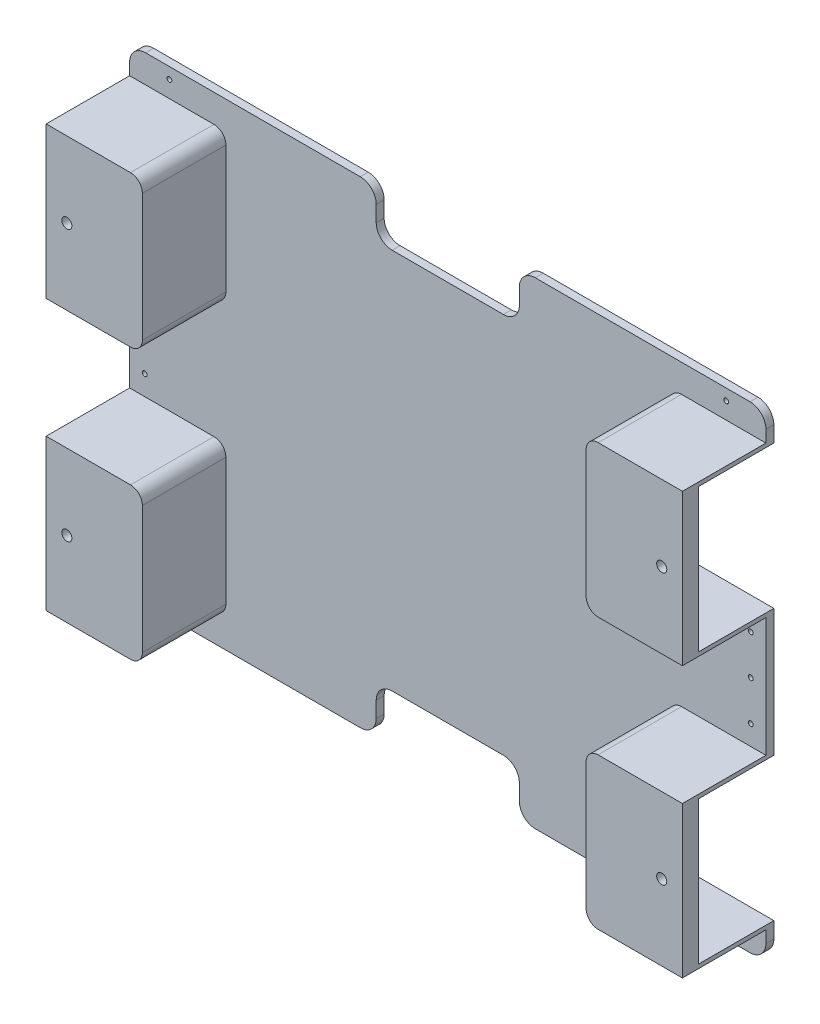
SolidWorks part; units mm, degrees
ref_plane "Plan de face" through (0, 0, 0) normal (0, 0, 1) x (1, 0, 0)
ref_plane "Plan de dessus" through (0, 0, 0) normal (0, 1, 0) x (1, 0, 0)
ref_plane "Plan de droite" through (0, 0, 0) normal (1, 0, 0) x (0, 0, -1)
sketch "Esquisse2" plane through (0, 0, 0) normal (0, 0, 1) x (1, 0, 0)
  line L0 (0, 0) -> (-800, 0) construction
  line L1 (-800, 300) -> (-490, 300)
  line L2 (-490, 300) -> (-490, 240)
  line L3 (-490, 240) -> (-310, 240)
  line L4 (-310, 240) -> (-310, 300)
  line L5 (-310, 300) -> (0, 300)
  line L6 (0, 300) -> (0, -300)
  line L7 (-800, 300) -> (-800, -300)
  line L8 (-310, -300) -> (0, -300)
  line L9 (-310, -240) -> (-310, -300)
  line L10 (-490, -240) -> (-310, -240)
  line L11 (-490, -300) -> (-490, -240)
  line L12 (-800, -300) -> (-490, -300)
  point P11 (-400, 0)
  point P12 (-400, 240)
  dimension "D1" = 800
  dimension "D2" = 300
  dimension "D3" = 60
  dimension "D4" = 180
extrude "Boss.-Extru.1" add sketch "Esquisse2" along normal blind 10
fillet "Congé1" radius 20 12 edges at (-800, 300, 5) (-490, 300, 5) (-490, 240, 5) (-310, 240, 5) (-310, 300, 5) (0, -300, 5) (-310, -300, 5) (-310, -240, 5) (-490, -240, 5) (-490, -300, 5) (-800, -300, 5) (0, 300, 5)
sketch "Esquisse3" plane through (0, 0, 10) normal (0, 0, 1) x (1, 0, 0)
  line L0 (-800, 280) -> (-800, -280) construction
  line L1 (-750, 286) -> (-50, 286) construction
  line L2 (-750, 286) -> (-750, -286) construction
  line L3 (-750, -286) -> (-50, -286) construction
  line L4 (-50, 286) -> (-50, -286) construction
  line L5 (-330, 240) -> (-470, 240) construction
  line L6 (-510, 300) -> (-780, 300) construction
  circle A0 centre (-750, 286) radius 3
  circle A1 centre (-50, 286) radius 3
  circle A2 centre (-750, -286) radius 3
  circle A3 centre (-50, -286) radius 3
  point P6 (-800, 0)
  point P7 (-750, 0)
  point P10 (-400, 240)
  point P11 (-400, 286)
  dimension "D3" = 6
  dimension "D4" = 6
  dimension "D5" = 6
  dimension "D6" = 6
  dimension "D1" = 14
  dimension "D2" = 50
extrude "Enlèv. mat.-Extru.1" cut sketch "Esquisse3" against normal through all
sketch "Esquisse4" plane through (0, 0, 10) normal (0, 0, 1) x (1, 0, 0)
  line L0 (0, -280) -> (0, 280) construction
  line L1 (0, 80) -> (-116, 80)
  line L2 (0, 80) -> (0, 260)
  line L3 (0, 260) -> (-116, 260)
  line L4 (-116, 80) -> (-116, 260)
  line L5 (-400, 240) -> (-400, -240) construction
  line L6 (-330, 240) -> (-470, 240) construction
  line L7 (-470, -240) -> (-330, -240) construction
  line L8 (-684, 80) -> (-684, 260)
  line L9 (-800, 260) -> (-684, 260)
  line L10 (-800, 80) -> (-800, 260)
  line L11 (-800, 80) -> (-684, 80)
  line L12 (-20, 300) -> (-290, 300) construction
  line L13 (-800, 0) -> (0, 0) construction
  line L14 (-800, 280) -> (-800, -280) construction
  line L15 (-800, -80) -> (-684, -80)
  line L16 (-800, -80) -> (-800, -260)
  line L17 (-800, -260) -> (-684, -260)
  line L18 (-684, -80) -> (-684, -260)
  line L19 (-116, -80) -> (-116, -260)
  line L20 (0, -260) -> (-116, -260)
  line L21 (0, -80) -> (0, -260)
  line L22 (0, -80) -> (-116, -80)
  dimension "D1" = 180
  dimension "D2" = 116
  dimension "D3" = 40
extrude "Enlèv. mat.-Extru.2" cut sketch "Esquisse4" against normal through all
fillet "Congé2" radius 10 8 edges at (-116, 80, 5) (-116, 260, 5) (-684, 80, 5) (-684, 260, 5) (-684, -260, 5) (-116, -260, 5) (-116, -80, 5) (-684, -80, 5)
sketch "Esquisse5" plane through (0, 0, 10) normal (0, 0, 1) x (1, 0, 0)
  line L0 (-800, 265) -> (-694, 265)
  line L5 (-679, 250) -> (-679, 90)
  line L6 (-694, 75) -> (-800, 75)
  line L7 (0, 75) -> (-106, 75)
  line L8 (-121, 90) -> (-121, 250)
  line L9 (-106, 265) -> (0, 265)
  line L10 (0, -265) -> (-106, -265)
  line L11 (-121, -250) -> (-121, -90)
  line L12 (-106, -75) -> (0, -75)
  line L13 (-800, -75) -> (-694, -75)
  line L14 (-679, -90) -> (-679, -250)
  line L15 (-694, -265) -> (-800, -265)
  line L16 (-800, 260) -> (-800, 265)
  line L17 (-800, 80) -> (-800, 75)
  line L18 (0, 80) -> (0, 75)
  line L19 (0, 260) -> (0, 265)
  line L20 (0, -260) -> (0, -265)
  line L21 (0, -80) -> (0, -75)
  line L22 (-800, -80) -> (-800, -75)
  line L23 (-800, -260) -> (-800, -265)
  line L29 (-106, -80) -> (0, -80)
  line L30 (0, -80) -> (0, 80)
  line L31 (0, 80) -> (-106, 80)
  line L32 (-116, 90) -> (-116, 250)
  line L33 (-106, 260) -> (0, 260)
  line L34 (0, 260) -> (0, 280)
  line L35 (-20, 300) -> (-290, 300)
  line L36 (-310, 280) -> (-310, 260)
  line L37 (-330, 240) -> (-470, 240)
  line L38 (-490, 260) -> (-490, 280)
  line L39 (-510, 300) -> (-780, 300)
  line L40 (-800, 280) -> (-800, 260)
  line L41 (-800, 260) -> (-694, 260)
  line L42 (-684, 250) -> (-684, 90)
  line L43 (-694, 80) -> (-800, 80)
  line L44 (-800, 80) -> (-800, -80)
  line L45 (-800, -80) -> (-694, -80)
  line L46 (-684, -90) -> (-684, -250)
  line L47 (-694, -260) -> (-800, -260)
  line L48 (-800, -260) -> (-800, -280)
  line L49 (-780, -300) -> (-510, -300)
  line L50 (-490, -280) -> (-490, -260)
  line L51 (-470, -240) -> (-330, -240)
  line L52 (-310, -260) -> (-310, -280)
  line L53 (-290, -300) -> (-20, -300)
  line L54 (0, -280) -> (0, -260)
  line L55 (0, -260) -> (-106, -260)
  line L56 (-116, -250) -> (-116, -90)
  line L57 (-106, -80) -> (0, -80)
  line L59 (0, 80) -> (-106, 80)
  line L60 (-116, 90) -> (-116, 250)
  line L61 (-106, 260) -> (0, 260)
  line L69 (-800, 260) -> (-694, 260)
  line L70 (-684, 250) -> (-684, 90)
  line L71 (-694, 80) -> (-800, 80)
  line L73 (-800, -80) -> (-694, -80)
  line L74 (-684, -90) -> (-684, -250)
  line L75 (-694, -260) -> (-800, -260)
  line L83 (0, -260) -> (-106, -260)
  line L84 (-116, -250) -> (-116, -90)
  arc A0 (-679, 250) -> (-694, 265) centre (-694, 250) ccw
  arc A1 (-694, 75) -> (-679, 90) centre (-694, 90) ccw
  arc A2 (-121, 90) -> (-106, 75) centre (-106, 90) ccw
  arc A3 (-106, 265) -> (-121, 250) centre (-106, 250) ccw
  arc A4 (-121, -250) -> (-106, -265) centre (-106, -250) ccw
  arc A5 (-106, -75) -> (-121, -90) centre (-106, -90) ccw
  arc A6 (-679, -90) -> (-694, -75) centre (-694, -90) ccw
  arc A7 (-694, -265) -> (-679, -250) centre (-694, -250) ccw
  arc A20 (-116, 90) -> (-106, 80) centre (-106, 90) ccw
  arc A21 (-106, 260) -> (-116, 250) centre (-106, 250) ccw
  arc A22 (0, 280) -> (-20, 300) centre (-20, 280) ccw
  arc A23 (-290, 300) -> (-310, 280) centre (-290, 280) ccw
  arc A24 (-330, 240) -> (-310, 260) centre (-330, 260) ccw
  arc A25 (-490, 260) -> (-470, 240) centre (-470, 260) ccw
  arc A26 (-490, 280) -> (-510, 300) centre (-510, 280) ccw
  arc A27 (-780, 300) -> (-800, 280) centre (-780, 280) ccw
  arc A28 (-684, 250) -> (-694, 260) centre (-694, 250) ccw
  arc A29 (-694, 80) -> (-684, 90) centre (-694, 90) ccw
  arc A30 (-684, -90) -> (-694, -80) centre (-694, -90) ccw
  arc A31 (-694, -260) -> (-684, -250) centre (-694, -250) ccw
  arc A32 (-800, -280) -> (-780, -300) centre (-780, -280) ccw
  arc A33 (-510, -300) -> (-490, -280) centre (-510, -280) ccw
  arc A34 (-470, -240) -> (-490, -260) centre (-470, -260) ccw
  arc A35 (-310, -260) -> (-330, -240) centre (-330, -260) ccw
  arc A36 (-310, -280) -> (-290, -300) centre (-290, -280) ccw
  arc A37 (-20, -300) -> (0, -280) centre (-20, -280) ccw
  arc A38 (-116, -250) -> (-106, -260) centre (-106, -250) ccw
  arc A39 (-106, -80) -> (-116, -90) centre (-106, -90) ccw
  arc A40 (-116, 90) -> (-106, 80) centre (-106, 90) ccw
  arc A41 (-106, 260) -> (-116, 250) centre (-106, 250) ccw
  arc A48 (-684, 250) -> (-694, 260) centre (-694, 250) ccw
  arc A49 (-694, 80) -> (-684, 90) centre (-694, 90) ccw
  arc A50 (-684, -90) -> (-694, -80) centre (-694, -90) ccw
  arc A51 (-694, -260) -> (-684, -250) centre (-694, -250) ccw
  arc A58 (-116, -250) -> (-106, -260) centre (-106, -250) ccw
  arc A59 (-106, -80) -> (-116, -90) centre (-106, -90) ccw
  dimension "D2" = 5
  dimension "D1" = 0
extrude "Boss.-Extru.2" add sketch "Esquisse5" along normal blind 85
sketch "Esquisse6" plane through (0, 0, 95) normal (0, 0, 1) x (1, 0, 0)
  line L1 (-800, -75) -> (-800, -80)
  line L2 (0, 265) -> (0, 260)
  line L3 (0, -75) -> (0, -80)
  line L5 (-800, -260) -> (-800, -265)
  line L6 (0, -260) -> (0, -265)
  line L7 (0, 80) -> (0, 75)
  line L8 (-800, 265) -> (-800, 260)
  line L9 (-694, 265) -> (-800, 265)
  line L10 (-679, 90) -> (-679, 250)
  line L11 (-800, 75) -> (-694, 75)
  line L12 (-800, 80) -> (-800, 75)
  line L13 (-694, 80) -> (-800, 80)
  line L14 (-684, 250) -> (-684, 90)
  line L15 (-800, 260) -> (-694, 260)
  line L17 (-694, 265) -> (-800, 265)
  line L18 (-679, 90) -> (-679, 250)
  line L19 (-800, 75) -> (-694, 75)
  line L24 (-121, 250) -> (-121, 90)
  line L25 (0, 265) -> (-106, 265)
  line L26 (0, 260) -> (0, 265)
  line L27 (-106, 260) -> (0, 260)
  line L28 (-116, 90) -> (-116, 250)
  line L29 (0, 80) -> (-106, 80)
  line L30 (0, 75) -> (0, 80)
  line L31 (-106, 75) -> (0, 75)
  line L32 (-121, 250) -> (-121, 90)
  line L33 (0, 265) -> (-106, 265)
  line L34 (0, 260) -> (0, 265)
  line L38 (0, 75) -> (0, 80)
  line L39 (-106, 75) -> (0, 75)
  line L40 (-679, -250) -> (-679, -90)
  line L41 (-800, -265) -> (-694, -265)
  line L42 (-800, -260) -> (-800, -265)
  line L43 (-694, -260) -> (-800, -260)
  line L44 (-684, -90) -> (-684, -250)
  line L45 (-800, -80) -> (-694, -80)
  line L46 (-800, -75) -> (-800, -80)
  line L47 (-694, -75) -> (-800, -75)
  line L48 (-679, -250) -> (-679, -90)
  line L49 (-800, -265) -> (-694, -265)
  line L50 (-800, -260) -> (-800, -265)
  line L54 (-800, -75) -> (-800, -80)
  line L55 (-694, -75) -> (-800, -75)
  line L56 (-106, -80) -> (0, -80)
  line L57 (0, -80) -> (0, -75)
  line L58 (0, -75) -> (-106, -75)
  line L59 (-121, -90) -> (-121, -250)
  line L60 (-106, -265) -> (0, -265)
  line L61 (0, -265) -> (0, -260)
  line L62 (0, -260) -> (-106, -260)
  line L63 (-116, -250) -> (-116, -90)
  line L65 (0, -80) -> (0, -75)
  line L66 (0, -75) -> (-106, -75)
  line L67 (-121, -90) -> (-121, -250)
  line L68 (-106, -265) -> (0, -265)
  line L69 (0, -265) -> (0, -260)
  line L72 (-800, 265) -> (-800, 75)
  line L73 (-800, -80) -> (-800, -260)
  line L74 (0, -80) -> (0, -260)
  line L75 (0, 260) -> (0, 80)
  arc A4 (-679, 250) -> (-694, 265) centre (-694, 250) ccw
  arc A5 (-694, 75) -> (-679, 90) centre (-694, 90) ccw
  arc A6 (-694, 80) -> (-684, 90) centre (-694, 90) ccw
  arc A7 (-684, 250) -> (-694, 260) centre (-694, 250) ccw
  arc A8 (-679, 250) -> (-694, 265) centre (-694, 250) ccw
  arc A9 (-694, 75) -> (-679, 90) centre (-694, 90) ccw
  arc A12 (-106, 265) -> (-121, 250) centre (-106, 250) ccw
  arc A13 (-106, 260) -> (-116, 250) centre (-106, 250) ccw
  arc A14 (-116, 90) -> (-106, 80) centre (-106, 90) ccw
  arc A15 (-121, 90) -> (-106, 75) centre (-106, 90) ccw
  arc A16 (-106, 265) -> (-121, 250) centre (-106, 250) ccw
  arc A19 (-121, 90) -> (-106, 75) centre (-106, 90) ccw
  arc A20 (-694, -265) -> (-679, -250) centre (-694, -250) ccw
  arc A21 (-694, -260) -> (-684, -250) centre (-694, -250) ccw
  arc A22 (-684, -90) -> (-694, -80) centre (-694, -90) ccw
  arc A23 (-679, -90) -> (-694, -75) centre (-694, -90) ccw
  arc A24 (-694, -265) -> (-679, -250) centre (-694, -250) ccw
  arc A27 (-679, -90) -> (-694, -75) centre (-694, -90) ccw
  arc A28 (-106, -80) -> (-116, -90) centre (-106, -90) ccw
  arc A29 (-106, -75) -> (-121, -90) centre (-106, -90) ccw
  arc A30 (-121, -250) -> (-106, -265) centre (-106, -250) ccw
  arc A31 (-116, -250) -> (-106, -260) centre (-106, -250) ccw
  arc A33 (-106, -75) -> (-121, -90) centre (-106, -90) ccw
  arc A34 (-121, -250) -> (-106, -265) centre (-106, -250) ccw
  dimension "D1" = 0
  dimension "D2" = 0
  dimension "D3" = 0
  dimension "D4" = 0
extrude "Boss.-Extru.3" add sketch "Esquisse6" along normal blind 20 contours M60 M49 M50 M51 M52 M53 M54 M55 M56 M57 M58 M59 | L72 M50 M54 M53 M52 M51 | L48 A27 L55 L1 L73 L5 L49 A24 | L67 A34 L68 L6 L74 L3 L66 A33 | L32 A19 L39 L7 L75 L2 L33 A16
sketch "Esquisse7" plane through (0, 0, 115) normal (0, 0, 1) x (1, 0, 0)
  line L0 (-800, 265) -> (-800, 75) construction
  line L1 (-400, 240) -> (-400, -240) construction
  line L2 (-330, 240) -> (-470, 240) construction
  line L3 (-470, -240) -> (-330, -240) construction
  line L4 (-800, 0) -> (0, 0) construction
  line L5 (-800, 75) -> (-800, -75) construction
  circle A0 centre (-774, 170) radius 6.35
  circle A1 centre (-26, 170) radius 6.35
  circle A2 centre (-774, -170) radius 6.35
  circle A3 centre (-26, -170) radius 6.35
  point P7 (-800, 170)
  point P17 (-800, 0)
  dimension "D1" = 12.7
  dimension "D2" = 26
extrude "Enlèv. mat.-Extru.3" cut sketch "Esquisse7" against normal up to next
sketch "Esquisse8" plane through (0, 0, 10) normal (0, 0, 1) x (1, 0, 0)
  line L0 (-781, 50) -> (-781, -50) construction
  line L1 (-800, 75) -> (-800, -75) construction
  line L2 (-400, 240) -> (-400, -240) construction
  line L3 (-330, 240) -> (-470, 240) construction
  line L4 (-470, -240) -> (-330, -240) construction
  line L5 (-19, 50) -> (-19, -50) construction
  circle A0 centre (-781, 50) radius 3
  circle A1 centre (-781, 0) radius 3
  circle A2 centre (-781, -50) radius 3
  circle A3 centre (-19, -50) radius 3
  circle A4 centre (-19, 0) radius 3
  circle A5 centre (-19, 50) radius 3
  point P12 (-800, 0)
  dimension "D1" = 6
  dimension "D2" = 19
  dimension "D3" = 50
  dimension "D4" = 50
  dimension "D5" = 100
extrude "Enlèv. mat.-Extru.4" cut sketch "Esquisse8" against normal through all
